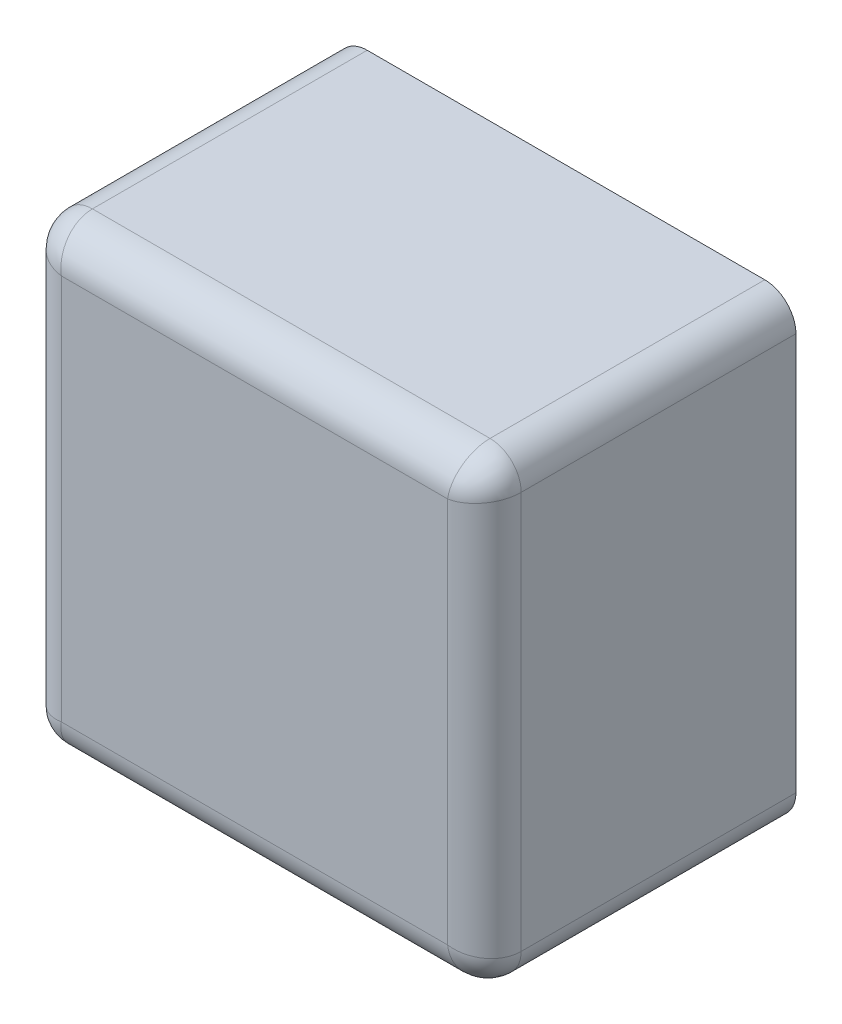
SolidWorks part; units mm, degrees
ref_plane "Front Plane" through (0, 0, 0) normal (1, 0, 0) x (0, 1, 0)
ref_plane "Top Plane" through (0, 0, 0) normal (0, 0, 1) x (0, 1, 0)
ref_plane "Right Plane" through (0, 0, 0) normal (0, 1, 0) x (-1, 0, 0)
sketch "Sketch1" plane through (0, 0, 0) normal (0, 0, 1) x (0, 1, 0)
  line L0 (-9225, -7975.6) -> (-9225, -9225)
  line L1 (-7975.6, 9225) -> (7975.6, 9225)
  line L2 (-9225, 7975.6) -> (-9225, -7975.6)
  line L3 (-7975.6, -9225) -> (7975.6, -9225)
  line L4 (9225, 7975.6) -> (9225, -7975.6)
  line L5 (-9225, 9225) -> (9225, -9225) construction
  line L6 (-9225, -9225) -> (9225, 9225) construction
  line L7 (-7975.6, -9225) -> (-9225, -9225)
  line L8 (7975.6, -9225) -> (9225, -9225)
  line L9 (7975.6, 9225) -> (9225, 9225)
  line L10 (9225, -7975.6) -> (9225, -9225)
  line L11 (9225, 7975.6) -> (9225, 9225)
  line L12 (-7975.6, 9225) -> (-9225, 9225)
  line L13 (-9225, 9225) -> (-9225, 7975.6)
  arc A0 (7975.6, -9225) -> (9225, -7975.6) centre (7975.6, -7975.6) ccw construction
  arc A1 (-9225, -7975.6) -> (-7975.6, -9225) centre (-7975.6, -7975.6) ccw construction
  arc A2 (7975.6, 9225) -> (9225, 7975.6) centre (7975.6, 7975.6) cw construction
  arc A3 (-7975.6, 9225) -> (-9225, 7975.6) centre (-7975.6, 7975.6) ccw construction
  point P0 (0, 0)
  dimension "D3" = 1249.4
  dimension "D1" = 18450
  dimension "D2" = 18450
sketch "Sketch3" plane through (0, 0, 0) normal (0, 0, 1) x (0, 1, 0)
  line L0 (-10000, 0) -> (10000, 0)
  line L1 (-10606.6017, -10606.6017) -> (10606.6017, 10606.6017)
  line L2 (0, 9701.9517) -> (0, -9701.9517)
  line L3 (-10606.6017, 10606.6017) -> (10606.6017, -10606.6017)
  point P2 (0, 0)
  point P5 (0, 0)
  point P8 (0, 0)
  point P12 (0, 0)
  dimension "D1" = 45
  dimension "D2" = 45
sketch "Sketch4" plane through (0, 0, 0) normal (0, 0, 1) x (0, 1, 0)
  line L5 (-8859.0592, -7750.6032) -> (-8859.0592, -8859.0592) construction
  line L6 (-8579.6592, -8030.0032) -> (-8030.0032, -8030.0032) construction
  line L10 (-8579.6592, -8030.0032) -> (-8579.6592, -8579.6592) construction
  line L11 (-8579.6592, -8579.6592) -> (-8030.0032, -8579.6592) construction
  line L12 (-8030.0032, -8030.0032) -> (-8030.0032, -8579.6592) construction
  line L13 (-8859.0592, -8859.0592) -> (-7750.6032, -8859.0592) construction
  line L14 (-7750.6032, -7750.6032) -> (-7750.6032, -8859.0592) construction
  line L15 (-8859.0592, -7750.6032) -> (-7750.6032, -7750.6032) construction
  line L17 (-8350, 8350) -> (8350, 8350)
  line L18 (-8350, 8350) -> (-8350, -8350)
  line L19 (-8350, -8350) -> (8350, -8350)
  line L20 (8350, 8350) -> (8350, -8350)
  line L21 (-8350, 8350) -> (8350, -8350) construction
  line L22 (-8350, -8350) -> (8350, 8350) construction
  point P14 (0, 0)
  dimension "D1" = 549.656
  dimension "D2" = 549.656
  dimension "D4" = 16700
  dimension "D5" = 16700
  dimension "D3" = 279.4
extrude "Boss-Extrude1" add sketch "Sketch1" along normal blind 12500
fillet "Intersection Radius" radius 1249.4 4 edges at (-9225, -9225, 6250) (-9225, 9225, 6250) (9225, 9225, 6250) (9225, -9225, 6250)
fillet "Endcap Radius" radius 1476.8 8 edges at (-8859.0592, 8859.0592, 12500) (0, 9225, 12500) (8859.0592, 8859.0592, 12500) (9225, 0, 12500) (8859.0592, -8859.0592, 12500) (0, -9225, 12500) (-8859.0592, -8859.0592, 12500) (-9225, 0, 12500)
